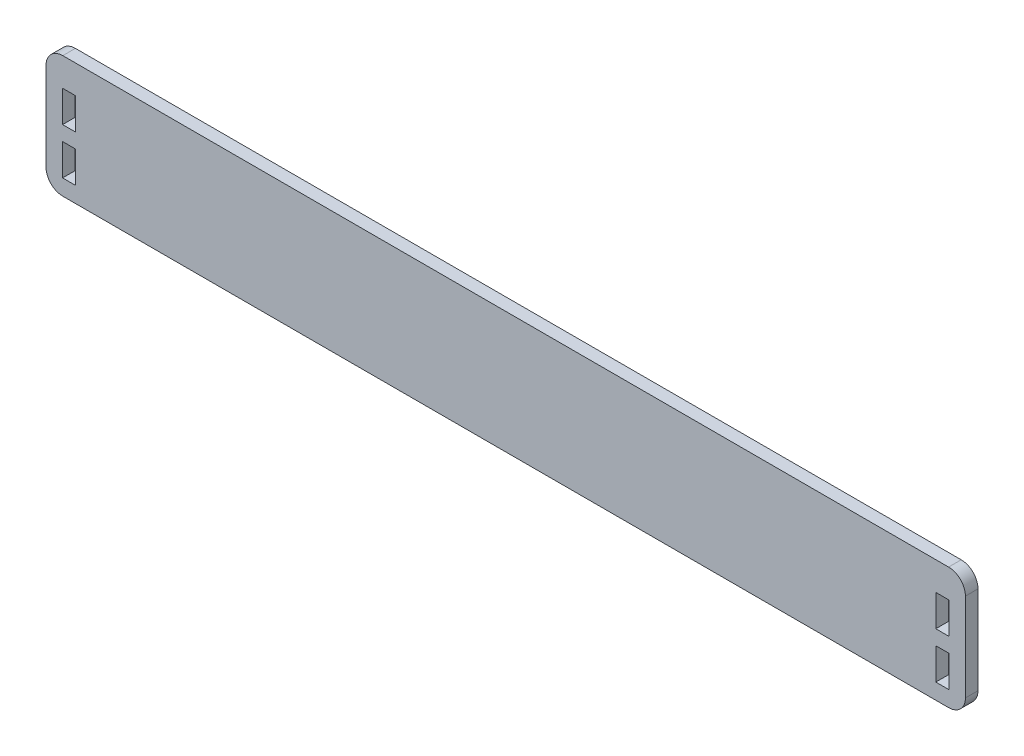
SolidWorks part; units mm, degrees
ref_plane "Front" through (0, 0, 0) normal (0, 0, 1) x (1, 0, 0)
ref_plane "Top" through (0, 0, 0) normal (0, 1, 0) x (1, 0, 0)
ref_plane "Right" through (0, 0, 0) normal (1, 0, 0) x (0, 0, -1)
sketch "Sketch1" plane through (0, 0, 0) normal (0, 0, 1) x (1, 0, 0)
  line L0 (-14, 52) -> (-14, 16) construction
  line L1 (-14, 66) -> (424, 66)
  line L2 (-14, 66) -> (-14, 8)
  line L3 (-14, 8) -> (424, 8)
  line L4 (424, 66) -> (424, 8)
  line L5 (424, 16) -> (424, 52) construction
  line L6 (-6, 8) -> (416, 8) construction
  line L7 (-10, 66) -> (420, 66) construction
extrude "Boss-Extrude1" add sketch "Sketch1" along normal blind 6
sketch "Sketch2" plane through (0, 0, 6) normal (0, 0, 1) x (1, 0, 0)
  line L0 (-14, 8) -> (424, 8) construction
  line L1 (205, 8) -> (205, 66) construction
  line L2 (424, 66) -> (-14, 66) construction
  line L3 (-14, 66) -> (-14, 8) construction
  line B0 (0.1, 37.5) -> (0.1, 52.5)
  line B1 (0.1, 52.5) -> (-6.1, 52.5)
  line B2 (-6.1, 52.5) -> (-6.1, 37.5)
  line B3 (-6.1, 37.5) -> (0.1, 37.5)
  line B4 (-3, 37.5) -> (-3, 52.5) construction
  line B5 (-6.1, 45) -> (0.1, 45) construction
  line B6 (0.1, 15.5) -> (0.1, 30.5)
  line B7 (0.1, 30.5) -> (-6.1, 30.5)
  line B8 (-6.1, 30.5) -> (-6.1, 15.5)
  line B9 (-6.1, 15.5) -> (0.1, 15.5)
  line B10 (-3, 15.5) -> (-3, 30.5) construction
  line B11 (-6.1, 23) -> (0.1, 23) construction
  line B12 (409.9, 37.5) -> (409.9, 52.5)
  line B13 (409.9, 52.5) -> (416.1, 52.5)
  line B14 (416.1, 52.5) -> (416.1, 37.5)
  line B15 (416.1, 37.5) -> (409.9, 37.5)
  line B16 (409.9, 15.5) -> (409.9, 30.5)
  line B17 (409.9, 30.5) -> (416.1, 30.5)
  line B18 (416.1, 30.5) -> (416.1, 15.5)
  line B19 (416.1, 15.5) -> (409.9, 15.5)
  dimension "D1" = 22
  dimension "D2" = 15
  dimension "D3" = 11
sketch_block_instance "Block-laser-cut-slot-15x6-1"
sketch_block "Block-laser-cut-slot-15x6" parameters "D1"=15, "D2"=6.2
sketch_block_instance "Block-laser-cut-slot-15x6-2"
sketch_block_instance "Block-laser-cut-slot-15x6-4"
sketch_block_instance "Block-laser-cut-slot-15x6-5"
extrude "holes for side panel tabs" cut sketch "Sketch2" against normal through all
fillet "Fillet1" radius 8 4 edges at (424, 8, 3) (424, 66, 3) (-14, 8, 3) (-14, 66, 3)
